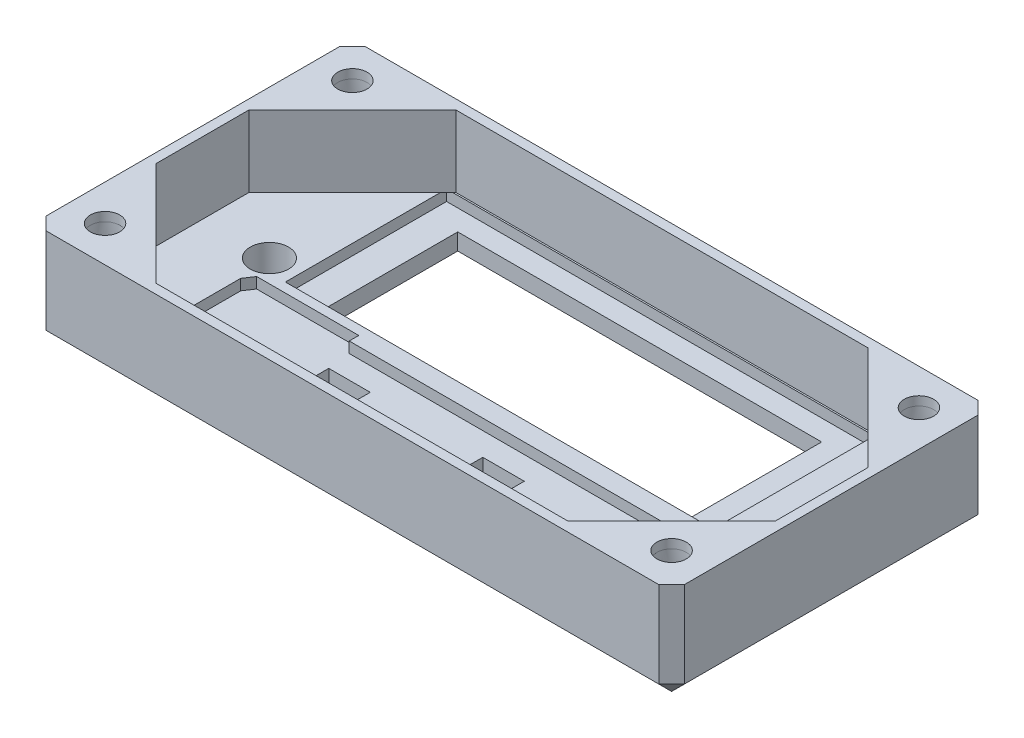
SolidWorks part; units mm, degrees
ref_plane "Front Plane" through (0, 0, 0) normal (0, 0, 1) x (1, 0, 0)
ref_plane "Top Plane" through (0, 0, 0) normal (0, 1, 0) x (1, 0, 0)
ref_plane "Right Plane" through (0, 0, 0) normal (1, 0, 0) x (0, 0, -1)
sketch "Sketch1" plane through (0, 0, 0) normal (0, 1, 0) x (1, 0, 0)
  line L0 (0, -8.5) -> (0, 0) construction
  line L1 (28.5, -10.5) -> (-28.5, -10.5)
  line L2 (28.5, -10.5) -> (28.5, 10.5)
  line L3 (28.5, 10.5) -> (-28.5, 10.5)
  line L4 (-28.5, -10.5) -> (-28.5, 10.5)
  line L5 (28.5, -10.5) -> (-28.5, 10.5) construction
  line L6 (28.5, 10.5) -> (-28.5, -10.5) construction
  line L7 (-50, -33.5) -> (50, -33.5)
  line L8 (-50, -33.5) -> (-50, 16.5)
  line L9 (-50, 16.5) -> (50, 16.5)
  line L10 (50, -33.5) -> (50, 16.5)
  line L11 (-50, -33.5) -> (50, 16.5) construction
  line L12 (-50, 16.5) -> (50, -33.5) construction
  line L13 (0, -13.5) -> (0, 0)
  line L14 (-36.5, -13.5) -> (36.5, -13.5) construction
  line L15 (-36.5, -13.5) -> (-36.5, -25.5) construction
  line L16 (-36.5, -25.5) -> (36.5, -25.5) construction
  line L17 (36.5, -13.5) -> (36.5, -25.5) construction
  line L18 (4.04, -23.615) -> (4.04, -17.115)
  line L19 (28.17, -23.615) -> (34.67, -23.615)
  line L20 (28.17, -23.615) -> (28.17, -17.115)
  line L21 (28.17, -17.115) -> (34.67, -17.115)
  line L22 (34.67, -23.615) -> (34.67, -17.115)
  line L23 (28.17, -23.615) -> (34.67, -17.115) construction
  line L24 (28.17, -17.115) -> (34.67, -23.615) construction
  line L25 (4.04, -23.615) -> (10.54, -23.615)
  line L26 (10.54, -23.615) -> (10.54, -17.115)
  line L27 (4.04, -17.115) -> (10.54, -17.115)
  line L28 (28.17, -23.615) -> (4.04, -23.615) construction
  line L29 (-20.09, -23.615) -> (-20.09, -17.115)
  line L30 (-20.09, -17.115) -> (-13.59, -17.115)
  line L31 (-13.59, -23.615) -> (-13.59, -17.115)
  line L32 (-20.09, -23.615) -> (-13.59, -23.615)
  line L33 (4.04, -23.615) -> (-20.09, -23.615) construction
  point P0 (0, 0)
  point P5 (0, -8.5)
  point P17 (31.42, -20.365)
  point P24 (34.67, -20.365)
  dimension "D8" = 6.5
  dimension "D1" = 57
  dimension "D2" = 21
  dimension "D3" = 100
  dimension "D4" = 50
  dimension "D5" = 6
  dimension "D6" = 73
  dimension "D7" = 12
  dimension "D9" = 6.5
  dimension "D10" = 5.135
  dimension "D11" = 5.08
  dimension "D12" = 6
  dimension "D14" = 24.13
  dimension "D16" = 24.13
  dimension "D13" = 2
  dimension "D15" = 2
extrude "Boss-Extrude1" add sketch "Sketch1" along normal blind 4.3
sketch "Sketch2" plane through (0, 4.3, 0) normal (0, 1, 0) x (1, 0, 0)
  line L0 (28.5, -10.5) -> (28.5, 10.5) construction
  line L1 (-28.5, -10.5) -> (-28.5, 10.5) construction
  line L4 (-28.5, -10.5) -> (-28.5, 10.5)
  line L5 (28.5, -10.5) -> (28.5, 10.5)
  line L6 (-33.5, -10.5) -> (-33.5, 14.75)
  line L7 (33.5, -10.5) -> (33.5, 14.75)
  line L8 (-33.5, 14.75) -> (33.5, 14.75)
  line L11 (-33.5, -10.5) -> (-28.5, -10.5)
  line L12 (28.5, -10.5) -> (33.5, -10.5)
  line L13 (-33.5, -10.5) -> (-33.5, 10.5) construction
  line L14 (33.5, -10.5) -> (33.5, 10.5) construction
  line L15 (-50, 16.5) -> (50, 16.5) construction
  line L16 (-28.5, 10.5) -> (28.5, 10.5)
  dimension "D1" = 5
  dimension "D2" = 5
  dimension "D3" = 1.75
sketch "Sketch4" plane through (0, 0, 0) normal (0, 1, 0) x (1, 0, 0)
  line L0 (-48.5, -32) -> (48.5, -32)
  line L1 (48.5, -32) -> (48.5, 15)
  line L2 (48.5, 15) -> (-48.5, 15)
  line L3 (-48.5, 15) -> (-48.5, -32)
  line L4 (-50, -33.5) -> (50, -33.5)
  line L5 (50, -33.5) -> (50, 16.5)
  line L6 (50, 16.5) -> (-50, 16.5)
  line L7 (-50, 16.5) -> (-50, -33.5)
  line L8 (-50, -33.5) -> (50, -33.5)
  line L9 (50, -33.5) -> (50, 16.5)
  line L10 (50, 16.5) -> (-50, 16.5)
  line L11 (-50, 16.5) -> (-50, -33.5)
  dimension "D1" = 0
  dimension "D2" = 1.5
sketch "Sketch5" plane through (0, 0, 0) normal (1, 0, 0) x (0, 0, -1)
  line L0 (16.5, 0) -> (-33.5, 0) construction
  line L1 (16.5, 0) -> (-33.5, 0) construction
  line L2 (-8.5, 0) -> (20.7216, 29.2216)
  line L3 (2.5325, 47.4107) -> (38.9107, 11.0325)
  point P6 (20.7216, 29.2216)
  dimension "D1" = 45
ref_plane "Plane1" [suppressed] through (0, 24.9716, -24.9716) normal (0, 0.7071, -0.7071) x (1, 0, 0)
extrude "Boss-Extrude4" add sketch "Sketch4" along normal blind 15.5
sketch "Sketch7" plane through (0, 4.3, 0) normal (0, 1, 0) x (1, 0, 0)
  line L0 (-50, 16.5) -> (50, -33.5) construction
  line L1 (-50, 16.5) -> (-50, -33.5) construction
  line L2 (-44.375, -27.875) -> (44.375, -27.875) construction
  line L3 (-44.375, -27.875) -> (-44.375, 10.875) construction
  line L4 (-44.375, 10.875) -> (44.375, 10.875) construction
  line L5 (44.375, -27.875) -> (44.375, 10.875) construction
  line L6 (-44.375, -27.875) -> (44.375, 10.875) construction
  line L7 (-44.375, 10.875) -> (44.375, -27.875) construction
  line L8 (50, 16.5) -> (-50, 16.5) construction
  line L9 (0, -8.5) -> (0, 16.5) construction
  line L10 (0, -8.5) -> (-50, -8.5) construction
  line L11 (-48.5, -1.205) -> (-32.295, 15)
  line L12 (-48.5, 15) -> (-48.5, -32) construction
  line L13 (48.5, 15) -> (-48.5, 15) construction
  line L14 (-32.295, 15) -> (-48.5, 15)
  line L15 (-48.5, 15) -> (-48.5, -1.205)
  line L16 (32.295, 15) -> (48.5, 15)
  line L17 (48.5, -1.205) -> (32.295, 15)
  line L18 (48.5, 15) -> (48.5, -1.205)
  line L19 (48.5, -15.795) -> (32.295, -32)
  line L20 (48.5, -32) -> (48.5, -15.795)
  line L21 (32.295, -32) -> (48.5, -32)
  line L22 (-32.295, -32) -> (-48.5, -32)
  line L23 (-48.5, -15.795) -> (-32.295, -32)
  line L24 (-48.5, -32) -> (-48.5, -15.795)
  circle A1 centre (-44.375, 10.875) radius 3.75 construction
  circle A2 centre (44.375, 10.875) radius 3.75 construction
  circle A3 centre (44.375, -27.875) radius 3.75 construction
  circle A4 centre (-44.375, -27.875) radius 3.75 construction
  point P2 (0, -8.5)
extrude "Boss-Extrude5" add sketch "Sketch7" along normal up to surface (11.2 mm away)
sketch "Sketch8" plane through (0, 15.5, 0) normal (0, 1, 0) x (1, 0, 0)
  circle A0 centre (-44.375, 10.875) radius 2.3
  circle A1 centre (44.375, 10.875) radius 2.3
  circle A2 centre (44.375, -27.875) radius 2.3
  circle A3 centre (-44.375, -27.875) radius 2.3
  point P0 (44.375, 10.875)
  point P2 (44.375, -27.875)
  point P4 (-44.375, -27.875)
  point P6 (-44.375, 10.875)
  dimension "D1" = 4.6
extrude "Cut-Extrude1" cut sketch "Sketch8" against normal through all
sketch "Sketch9" plane through (0, 0, 0) normal (0, -1, 0) x (1, 0, 0)
  circle A0 centre (-44.375, 27.875) radius 3.5
  circle A1 centre (44.375, 27.875) radius 3.5
  circle A2 centre (44.375, -10.875) radius 3.5
  circle A3 centre (-44.375, -10.875) radius 3.5
  dimension "D1" = 7
extrude "Cut-Extrude2" cut sketch "Sketch9" against normal blind 4
sketch "Sketch10" plane through (0, 4, 0) normal (0, -1, 0) x (1, 0, 0)
  circle A0 centre (-44.375, -10.875) radius 3.5 construction
  circle A1 centre (44.375, -10.875) radius 3.5 construction
  circle A2 centre (44.375, 27.875) radius 3.5 construction
  circle A4 centre (-44.375, -10.875) radius 3.5 construction
  circle A5 centre (44.375, -10.875) radius 3.5 construction
  circle A6 centre (44.375, 27.875) radius 3.5 construction
  circle A8 centre (-44.375, 27.875) radius 3
  circle A9 centre (-44.375, 27.875) radius 3.5 construction
  dimension "D1" = 0.5
sketch "Sketch11" plane through (0, 15.5, 0) normal (0, 1, 0) x (1, 0, 0)
  circle A0 centre (44.375, -27.875) radius 2.3 construction
  circle A1 centre (44.375, 10.875) radius 2.3 construction
  circle A2 centre (-44.375, -27.875) radius 2.3 construction
  circle A3 centre (-44.375, 10.875) radius 2.3 construction
  circle A4 centre (44.375, -27.875) radius 2.3 construction
  circle A5 centre (44.375, 10.875) radius 2.3 construction
  circle A6 centre (-44.375, -27.875) radius 2.3
  circle A7 centre (-44.375, 10.875) radius 2.3 construction
loft "Cut-Loft1" cut profiles "Sketch10", "Sketch11"
mirror "Mirror1" about plane through (0, 0, 0) normal (1, 0, 0) of "Cut-Loft1"
ref_plane "Plane2" through (0, 0, 8.5) normal (0, 0, 1) x (1, 0, 0)
mirror "Mirror2" about plane through (0, 0, 8.5) normal (0, 0, 1) of "Mirror1", "Cut-Loft1"
chamfer "Chamfer1" distance 2 angle 45 8 edges at (-50, 7.75, 33.5) (-50, 7.75, -16.5) (50, 7.75, -16.5) (50, 7.75, 33.5) (-50, 0, 8.5) (0, 0, -16.5) (50, 0, 8.5) (0, 0, 33.5)
sketch "Sketch14" plane through (0, 0, 0) normal (0, -1, 0) x (1, 0, 0)
  line L0 (-50, -14.5) -> (-50, 31.5) construction
  line L1 (-48, 33.5) -> (48, 33.5) construction
  circle A0 centre (-38, 8.5) radius 3
  dimension "D1" = 6
  dimension "D2" = 12
  dimension "D3" = 25
extrude "Cut-Extrude4" cut sketch "Sketch14" against normal up to next
sketch "Sketch12" plane through (0, 0, 0) normal (0, -1, 0) x (1, 0, 0)
  line L0 (35.3439, 30.115) -> (27.4961, 30.115) construction
  line L1 (27.4961, 30.115) -> (10.6098, 30.115) construction
  line L2 (10.6098, 30.115) -> (3.9702, 30.115) construction
  line L3 (3.9702, 30.115) -> (-5.6874, 30.115) construction
  line L4 (-5.6874, 30.115) -> (-27.9926, 30.115) construction
  line L5 (-16.84, 30.115) -> (-16.84, 23.615) construction
  line L6 (-20.09, 23.615) -> (-13.59, 23.615) construction
  line L7 (4.04, 23.615) -> (10.54, 23.615) construction
  line L8 (7.29, 30.115) -> (7.29, 23.615) construction
  line L9 (31.42, 23.615) -> (31.42, 30.115) construction
  line L10 (28.17, 23.615) -> (34.67, 23.615) construction
  line L11 (-38, 8.5) -> (-38, 18.5) construction
  line L12 (-25.57, 18.5) -> (-50.43, 18.5) construction
  text T0 "<b>+</b>" font "Century Gothic" height 7
  text T1 "<b>-</b>" font "Century Gothic" height 7
  text T2 "<b>ENTER</b>" font "Century Gothic" height 5
  text T3 "<b>PWR</b>  " font "Century Gothic" height 5
  point P25 (-38, 18.5)
  dimension "D1" = 6.5
  dimension "D2" = 10
extrude "Cut-Extrude5" cut sketch "Sketch12" against normal blind 1.6
extrude "Cut-Extrude6" cut sketch "Sketch2" against normal blind 1.7
sketch "Sketch15" plane through (0, 2.6, 0) normal (0, 1, 0) x (1, 0, 0)
  line L0 (-28.5, 10.5) -> (-28.5, 11.5)
  line L1 (-28.5, 11.5) -> (28.5, 11.5)
  line L2 (28.5, 11.5) -> (28.5, 10.5)
  line L3 (-28.5, 10.5) -> (28.5, 10.5) construction
  line L4 (-28.5, 10.5) -> (28.5, 10.5)
  dimension "D1" = 1
extrude "Cut-Extrude7" cut sketch "Sketch15" against normal through all
sketch "Sketch16" plane through (0, 4.3, 0) normal (0, 1, 0) x (1, 0, 0)
  line L0 (-36.5, -13.5) -> (-36.5, -25.5) construction
  line L1 (-36.5, -25.5) -> (36.5, -25.5) construction
  line L2 (36.5, -13.5) -> (36.5, -25.5) construction
  line L3 (-36.5, -13.5) -> (36.5, -13.5) construction
  line L4 (-36.5, -13.5) -> (-36.5, -25.5) construction
  line L5 (-36.5, -25.5) -> (36.5, -25.5)
  line L6 (36.5, -13.5) -> (36.5, -25.5)
  line L7 (-20.5, -13.5) -> (36.5, -13.5)
  line L8 (-36.5, -13.5) -> (-36.5, -12) construction
  line L9 (-36.5, -12) -> (-20.5, -12)
  line L10 (-20.5, -12) -> (-20.5, -13.5)
  line L11 (-36.5, -12) -> (-36.5, -25.5)
  dimension "D1" = 1.5
  dimension "D2" = 16
extrude "Cut-Extrude10" cut sketch "Sketch16" against normal blind 1.7
sketch "Sketch17" plane through (0, 4.3, 0) normal (0, 1, 0) x (1, 0, 0)
  line L0 (-36.5, -12) -> (-37.5, -13.5)
  line L1 (-37.5, -13.5) -> (-37.5, -25.5)
  line L2 (-37.5, -25.5) -> (-36.5, -25.5)
  line L3 (36.5, -13.5) -> (37.5, -13.5)
  line L4 (37.5, -13.5) -> (37.5, -25.5)
  line L5 (37.5, -25.5) -> (36.5, -25.5)
  line L6 (36.5, -25.5) -> (36.5, -13.5) construction
  line L7 (36.5, -25.5) -> (36.5, -13.5)
  line L8 (-36.5, -12) -> (-36.5, -25.5) construction
  line L9 (-36.5, -12) -> (-36.5, -25.5)
  dimension "D1" = 1
  dimension "D2" = 12
  dimension "D3" = 1
extrude "Cut-Extrude11" cut sketch "Sketch17" against normal blind 1.7
equation "\"D2@Sketch7\"=\"D1@Sketch7\"*.75"
equation "\"D3@Sketch7\"=\"D2@Sketch7\""
equation "\"D4@Sketch7\"=\"D3@Sketch7\""
